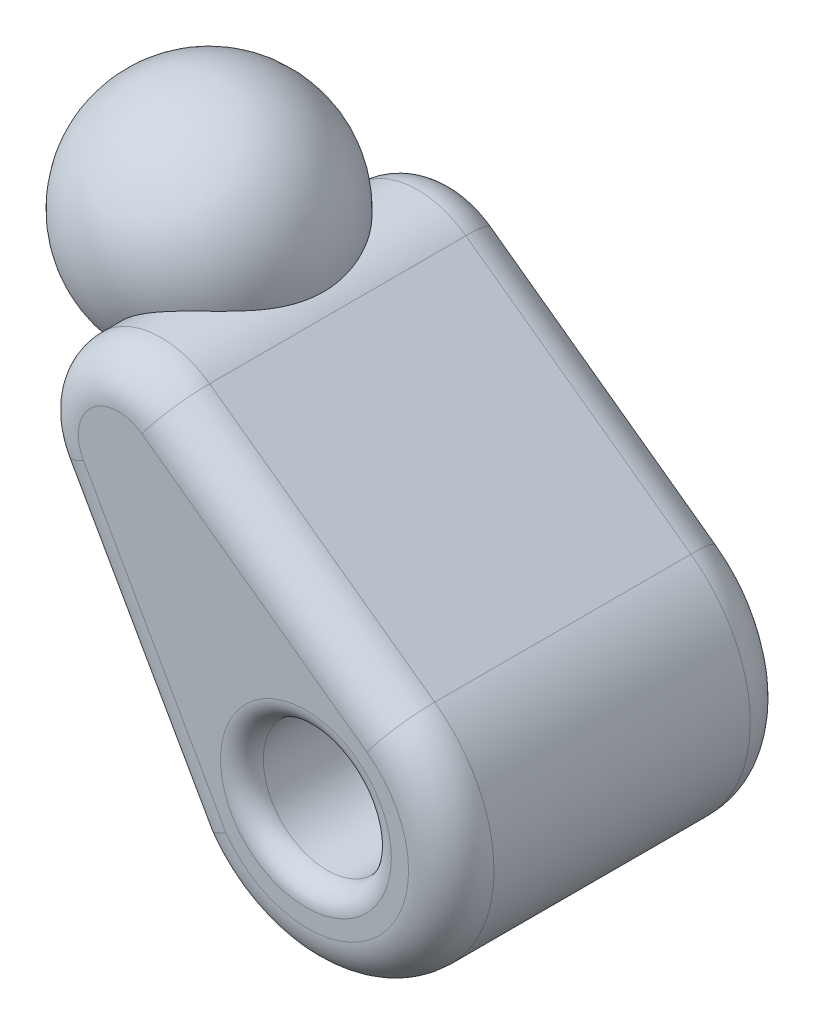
SolidWorks part; units mm, degrees
ref_plane "Plan de face" through (0, 0, 0) normal (0, 0, 1) x (1, 0, 0)
ref_plane "Plan de dessus" through (0, 0, 0) normal (0, 1, 0) x (1, 0, 0)
ref_plane "Plan de droite" through (0, 0, 0) normal (1, 0, 0) x (0, 0, -1)
sketch "Esquisse1" plane through (0, 0, 0) normal (0, 0, 1) x (1, 0, 0)
  line L0 (-27, 0) -> (27, 0)
  arc A0 (27, 0) -> (-27, 0) centre (0, 0) ccw
  dimension "D1" = 54
revolve "Révolution1" add sketch "Esquisse1" angle 360 about L0
sketch "Esquisse5" plane through (0, 0, 0) normal (0, 0, 1) x (1, 0, 0)
  line L0 (0, 0) -> (76.893, -86.1803) construction
sketch "Esquisse6" plane through (0, 0, 0) normal (0, 0, 1) x (1, 0, 0)
  line L0 (0, 0) -> (76.893, -86.1803) construction
  line L1 (30.1379, -5.3489) -> (82.8443, -43.5576)
  line L2 (1.9116, -30.584) -> (35.4717, -89.8168)
  arc A0 (35.4717, -89.8168) -> (82.8443, -43.5576) centre (63.1289, -70.7537) ccw
  arc A1 (30.1379, -5.3489) -> (1.9116, -30.584) centre (18.7672, -21.0339) ccw
extrude "Extrusion2" add sketch "Esquisse6" along normal mid plane 80
fillet "Congé1" radius 10 8 edges at (86.5969, -94.7865, -40) (18.6917, -60.2004, -40) (5.8551, -6.5913, -40) (86.5969, -94.7865, 40) (18.6917, -60.2004, 40) (5.8551, -6.5913, 40) (56.4911, -24.4532, -40) (56.4911, -24.4532, 40)
sketch "Esquisse7" plane through (0, 0, 40) normal (0, 0, 1) x (1, 0, 0)
  line L0 (0, 0) -> (76.893, -86.1803) construction
  circle A0 centre (62.6863, -70.2576) radius 15
  dimension "D1" = 30
extrude "Enlèv. mat.-Extru.1" cut sketch "Esquisse7" against normal through all
fillet "Congé3" radius 5 2 edges at (77.6863, -70.2576, -40) (77.6863, -70.2576, 40)
